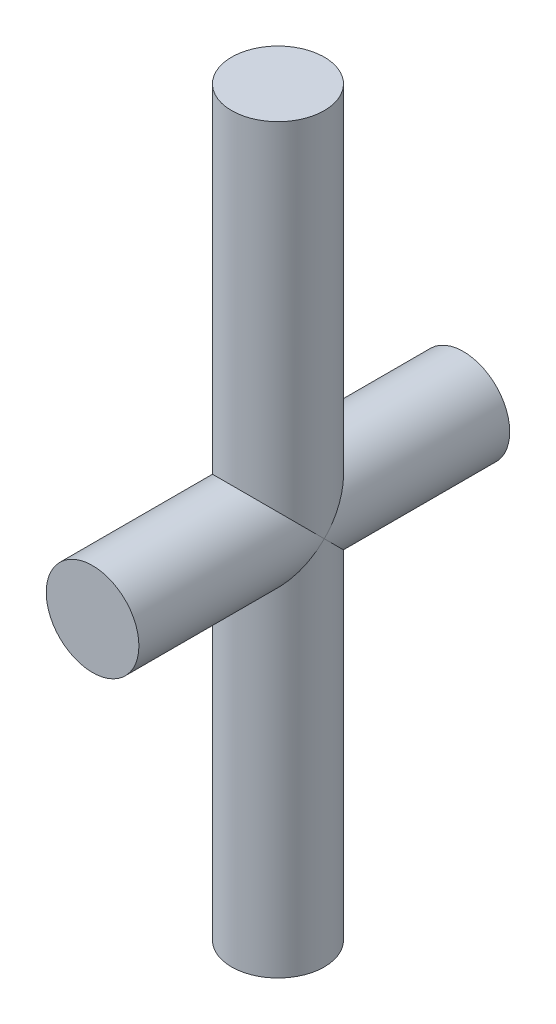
SolidWorks part; units mm, degrees
ref_plane "Front Plane" through (0, 0, 0) normal (0, 0, 1) x (1, 0, 0)
ref_plane "Top Plane" through (0, 0, 0) normal (0, 1, 0) x (1, 0, 0)
ref_plane "Right Plane" through (0, 0, 0) normal (1, 0, 0) x (0, 0, -1)
sketch "Sketch1" plane through (0, 0, 0) normal (0, 0, 1) x (1, 0, 0)
  circle A0 centre (0, 0) radius 12.5
  dimension "D1" = 25
extrude "Boss-Extrude1" add sketch "Sketch1" along normal mid plane 100
sketch "Sketch2" plane through (0, 0, 0) normal (0, 1, 0) x (1, 0, 0)
  line L0 (12.5, -50) -> (12.5, 50) construction
  circle A0 centre (0, 0) radius 12.5
extrude "Boss-Extrude2" add sketch "Sketch2" along normal mid plane 200
